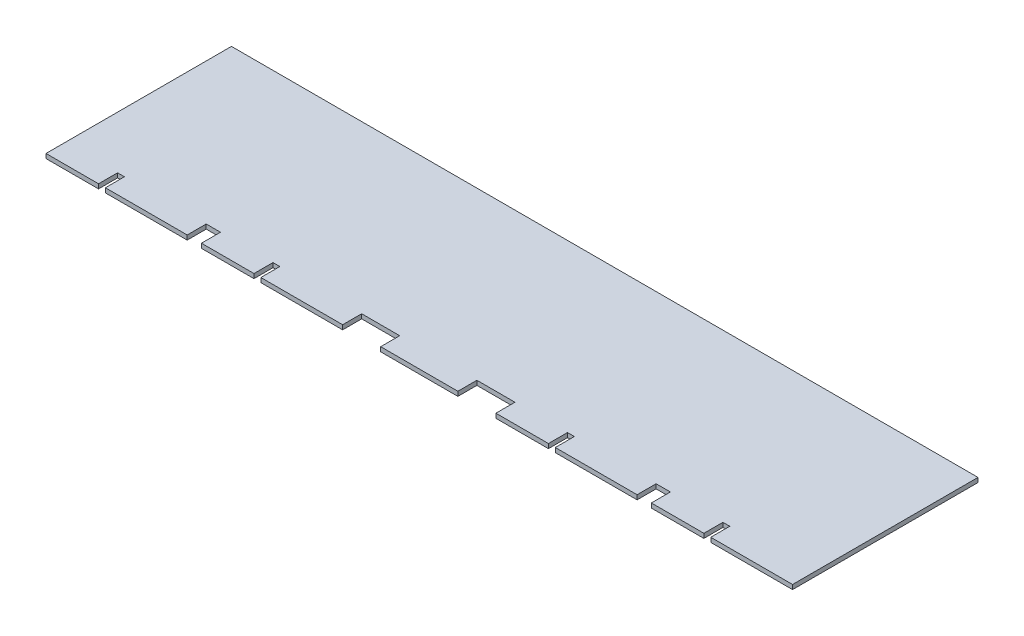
SolidWorks part; units mm, degrees
ref_plane "Front Plane" through (0, 0, 0) normal (0, 0, 1) x (1, 0, 0)
ref_plane "Top Plane" through (0, 0, 0) normal (0, 1, 0) x (1, 0, 0)
ref_plane "Right Plane" through (0, 0, 0) normal (1, 0, 0) x (0, 0, -1)
sketch "Sketch1" plane through (0, 0, 0) normal (0, 1, 0) x (1, 0, 0)
  line L0 (0, 0) -> (0, 64.389) construction
  line L1 (-129.6035, 0) -> (129.6035, 0)
  line L2 (-129.6035, 0) -> (-129.6035, 64.389)
  line L3 (-129.6035, 64.389) -> (129.6035, 64.389)
  line L4 (129.6035, 0) -> (129.6035, 64.389)
  line L5 (-111.3663, 0) -> (-108.9787, 0)
  line L6 (-111.3663, 0) -> (-111.3663, 6.604)
  line L7 (-111.3663, 6.604) -> (-108.9787, 6.604)
  line L8 (-108.9787, 0) -> (-108.9787, 6.604)
  line L9 (-75.6285, 0) -> (-80.5815, 0)
  line L10 (-75.6285, 0) -> (-75.6285, 6.604)
  line L11 (-75.6285, 6.604) -> (-80.5815, 6.604)
  line L12 (-80.5815, 0) -> (-80.5815, 6.604)
  line L13 (-57.3913, 0) -> (-55.0037, 0)
  line L14 (-57.3913, 0) -> (-57.3913, 6.604)
  line L15 (-57.3913, 6.604) -> (-55.0037, 6.604)
  line L16 (-55.0037, 0) -> (-55.0037, 6.604)
  line L17 (-26.6065, 0) -> (-13.3985, 0)
  line L18 (-26.6065, 0) -> (-26.6065, 6.604)
  line L19 (-26.6065, 6.604) -> (-13.3985, 6.604)
  line L20 (-13.3985, 0) -> (-13.3985, 6.604)
  line L21 (13.3985, 0) -> (26.6065, 0)
  line L22 (13.3985, 0) -> (13.3985, 6.604)
  line L23 (13.3985, 6.604) -> (26.6065, 6.604)
  line L24 (26.6065, 0) -> (26.6065, 6.604)
  line L25 (44.8437, 0) -> (47.2313, 0)
  line L26 (44.8437, 0) -> (44.8437, 6.604)
  line L27 (44.8437, 6.604) -> (47.2313, 6.604)
  line L28 (47.2313, 0) -> (47.2313, 6.604)
  line L29 (75.6285, 0) -> (80.5815, 0)
  line L30 (75.6285, 0) -> (75.6285, 6.604)
  line L31 (75.6285, 6.604) -> (80.5815, 6.604)
  line L32 (80.5815, 0) -> (80.5815, 6.604)
  line L33 (98.8187, 0) -> (101.2063, 0)
  line L34 (98.8187, 0) -> (98.8187, 6.604)
  line L35 (98.8187, 6.604) -> (101.2063, 6.604)
  line L36 (101.2063, 0) -> (101.2063, 6.604)
  dimension "D1" = 259.207
  dimension "D2" = 64.389
  dimension "D3" = 2.3876
  dimension "D4" = 2.3876
  dimension "D5" = 2.3876
  dimension "D6" = 2.3876
  dimension "D7" = 6.604
  dimension "D8" = 30.7848
  dimension "D9" = 30.7848
  dimension "D10" = 30.7848
  dimension "D11" = 30.7848
  dimension "D12" = 26.797
  dimension "D13" = 49.022
  dimension "D14" = 49.022
  dimension "D15" = 102.997
  dimension "D16" = 143.002
  dimension "D17" = 49.022
  dimension "D18" = 49.022
  dimension "D19" = 205.232
extrude "Extrude1" add sketch "Sketch1" along normal mid plane 1.55 contours L1 L0 L3 L2 L6 L7 L8 L12 L11 L10 L14 L15 L16 L18 L19 L20 | L0 L1 L22 L23 L24 L26 L27 L28 L30 L31 L32 L34 L35 L36 L4 L3
